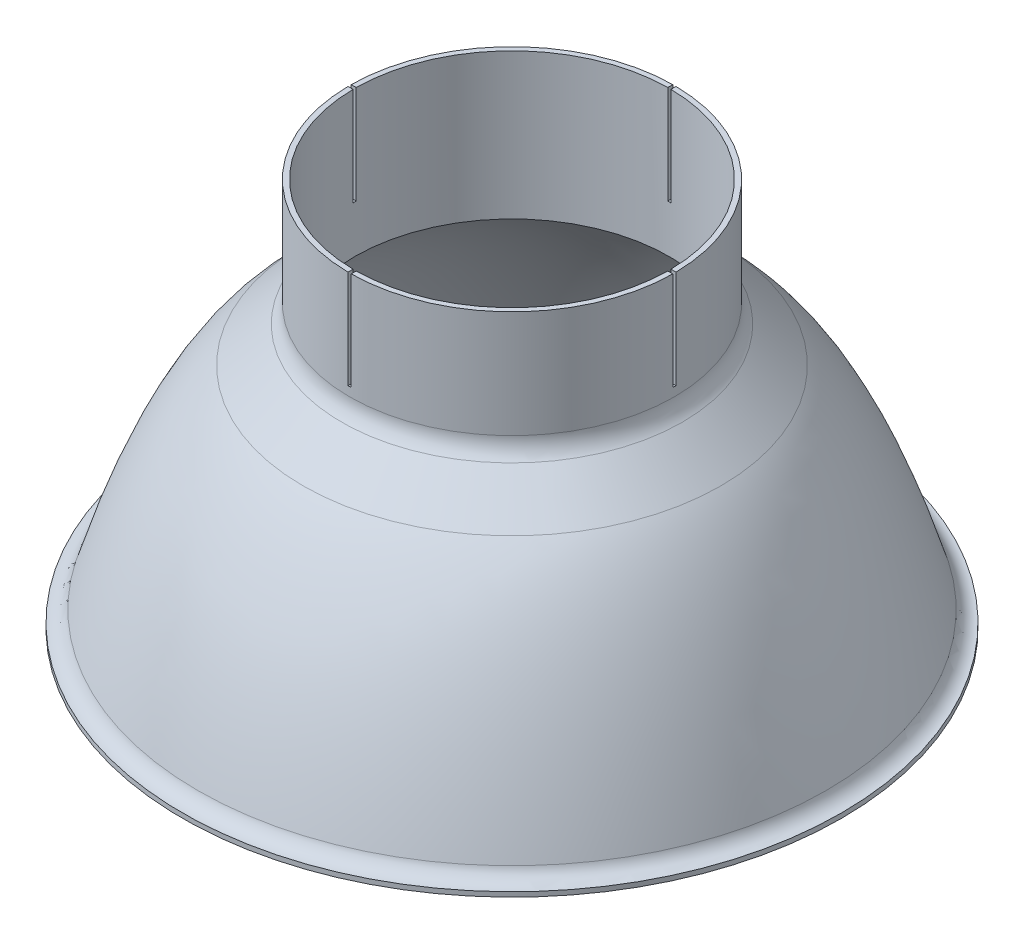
SolidWorks part; units mm, degrees
ref_plane "Front Plane" through (0, 0, 0) normal (0, 0, 1) x (1, 0, 0)
ref_plane "Top Plane" through (0, 0, 0) normal (0, 1, 0) x (1, 0, 0)
ref_plane "Right Plane" through (0, 0, 0) normal (1, 0, 0) x (0, 0, -1)
sketch "Sketch1" plane through (0, 0, 0) normal (0, 0, 1) x (1, 0, 0)
  line L0 (0, 0) -> (0, -43.2494) construction
  line L1 (67.4472, -24.8282) -> (50.8, -9.4165)
  line L3 (106.3986, -96.7904) -> (106.3986, -98.3165)
  line L4 (50.8, -9.4165) -> (50.8, -19.8295)
  arc A0 (101.3983, -93.055) -> (106.3986, -96.7904) centre (106.3986, -91.5758) ccw
  arc A1 (100.0032, -93.7056) -> (106.3986, -98.3165) centre (106.3986, -91.5758) ccw
  parabola Q0
  spline S1 degree 3 poles (67.4472, -24.8282) (68.0427, -25.3795) (69.3223, -26.6224) (72.9073, -30.4624) (78.043, -37.2313) (84.4312, -48.2373) (89.5073, -59.2036) (93.4307, -69.0606) (96.3052, -76.9933) (98.6484, -84.0663) (100.3315, -89.4837) (101.0963, -92.0342) (101.3983, -93.055) knots 0.502589 0.502589 0.502589 0.502589 0.502852 0.503158 0.504211 0.505264 0.506317 0.506843 0.50737 0.507896 0.508159 0.508335 0.508335 0.508335 0.508335
  dimension "D1" = 101.6
  dimension "D2" = 8.1926
  dimension "D3" = 200.0065
  dimension "D5" = 88.9
  dimension "D4" = 9.4165
  dimension "D6" = 1.5262
  dimension "D7" = 212.7973
  dimension "D8" = 10.4129
revolve "Revolve2" add sketch "Sketch1" angle 360 about L0
sketch "Sketch2" plane through (0, 0, 0) normal (0, 0, 1) x (1, 0, 0)
  line L0 (50.8, 27.1785) -> (50.8, -16.4499)
  line L1 (50.8, -16.4499) -> (52.4256, -10.9215)
  line L2 (52.4256, 27.1785) -> (52.4256, -10.9215)
  line L3 (67.4472, -24.8282) -> (50.8, -9.4165) construction
  line L4 (50.8, 27.1785) -> (52.4256, 27.1785)
  line L6 (0, 0) -> (0, -136.0167) construction
  line L7 (50.8, -16.4499) -> (64.421, 4.7091) construction
  line L8 (52.4256, -10.9215) -> (63.0541, 5.589) construction
  dimension "D2" = 38.1
  dimension "D3" = 50.8
  dimension "D1" = 1.6256
revolve "Revolve3" add sketch "Sketch2" angle 360 about L6
fillet "Fillet1" radius 7.9375 1 edges at (-52.4256, -10.9215, 0)
sketch "Sketch3" plane through (0, 0, 0) normal (0, 0, 1) x (1, 0, 0)
  line L0 (0, -4.5715) -> (0, 0) construction
  line L1 (-0.508, 48.502) -> (0.508, 48.502)
  line L2 (-0.508, 48.502) -> (-0.508, -4.5715)
  line L3 (-0.508, -4.5715) -> (0.508, -4.5715)
  line L4 (0.508, 48.502) -> (0.508, -4.5715)
  line L5 (52.4256, 27.1785) -> (-52.4256, 27.1785) construction
  dimension "D1" = 1.016
  dimension "D2" = 31.75
extrude "Extrude1" cut sketch "Sketch3" against normal through all and the other way through all
sketch "Sketch4" plane through (0, 0, 0) normal (1, 0, 0) x (0, 0, -1)
  line L0 (0, -4.5715) -> (0, 0) construction
  line L1 (-0.508, 37.9483) -> (0.508, 37.9483)
  line L2 (-0.508, 37.9483) -> (-0.508, -4.5715)
  line L3 (-0.508, -4.5715) -> (0.508, -4.5715)
  line L4 (0.508, 37.9483) -> (0.508, -4.5715)
  line L5 (52.4231, 27.1785) -> (-52.4231, 27.1785) construction
  dimension "D1" = 31.75
  dimension "D2" = 1.016
extrude "Extrude2" cut sketch "Sketch4" against normal through all and the other way through all
